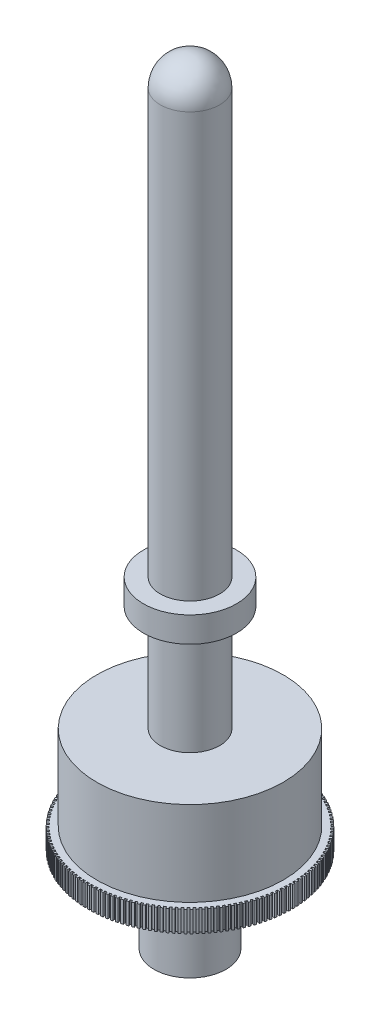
SolidWorks part; units mm, degrees
ref_plane "Front Plane" through (0, 0, 0) normal (0, 0, 1) x (1, 0, 0)
ref_plane "Top Plane" through (0, 0, 0) normal (0, 1, 0) x (1, 0, 0)
ref_plane "Right Plane" through (0, 0, 0) normal (1, 0, 0) x (0, 0, -1)
sketch "Sketch1" plane through (0, 0, 0) normal (0, 0, 1) x (1, 0, 0)
  line L0 (0, -1000) -> (0, 49000) construction
  line L2 (7, 0) -> (7, -100)
  line L3 (7, -100) -> (11, -100)
  line L4 (11, -100) -> (11, -106)
  line L5 (11, -106) -> (7, -106)
  line L6 (7, -106) -> (7, -131)
  line L7 (7, -131) -> (22, -131)
  line L8 (22, -131) -> (22, -151)
  line L9 (22, -151) -> (23.5, -151)
  line L10 (23.5, -151) -> (23.5, -156)
  line L11 (23.5, -156) -> (8.5, -156)
  line L12 (8.5, -156) -> (8.5, -176)
  line L13 (8.5, -176) -> (0, -176)
  line L15 (0, 7) -> (0, 0)
  line L16 (0, 7) -> (0, -176)
  arc A0 (7, 0) -> (0, 7) centre (0, 0) ccw
  point P12 (0, 0)
  point P18 (0, 0)
  dimension "D2" = 100
  dimension "D3" = 25
  dimension "D4" = 4
  dimension "D5" = 6
  dimension "D6" = 15
  dimension "D7" = 20
  dimension "D8" = 5
  dimension "D9" = 1.5
  dimension "D10" = 20
  dimension "D11" = 8.5
  dimension "D12" = 7
revolve "Revolve1" add sketch "Sketch1" angle 360 about L0
sketch "Sketch2" plane through (0, -176, 0) normal (0, -1, 0) x (1, 0, 0)
  circle A0 centre (0, 0) radius 5
  dimension "D1" = 10
extrude "Cut-Extrude1" cut sketch "Sketch2" against normal up to surface (20 mm away)
sketch "Sketch3" plane through (0, -156, 0) normal (0, -1, 0) x (1, 0, 0)
  line L0 (0, -1000) -> (0, 49000) construction
  line L1 (-0.25, 23.9987) -> (0.25, 23.9987)
  line L2 (-0.25, 23.9987) -> (-0.25, 23.4987)
  line L3 (0.25, 23.9987) -> (0.25, 23.4987)
  circle A2 centre (0, 0) radius 23.5
  arc A3 (0.25, 23.4987) -> (-0.25, 23.4987) centre (0, 0) ccw
  point P5 (0, 23.9987)
  dimension "D1" = 0.5
  dimension "D3" = 0.5
  dimension "D2" = 0
extrude "Boss-Extrude1" add sketch "Sketch3" against normal up to surface (5 mm away)
pattern_circular "CirPattern1" count 150 over 360 about axis through (0, 0, 0) along (0, 1, 0) of "Boss-Extrude1"
